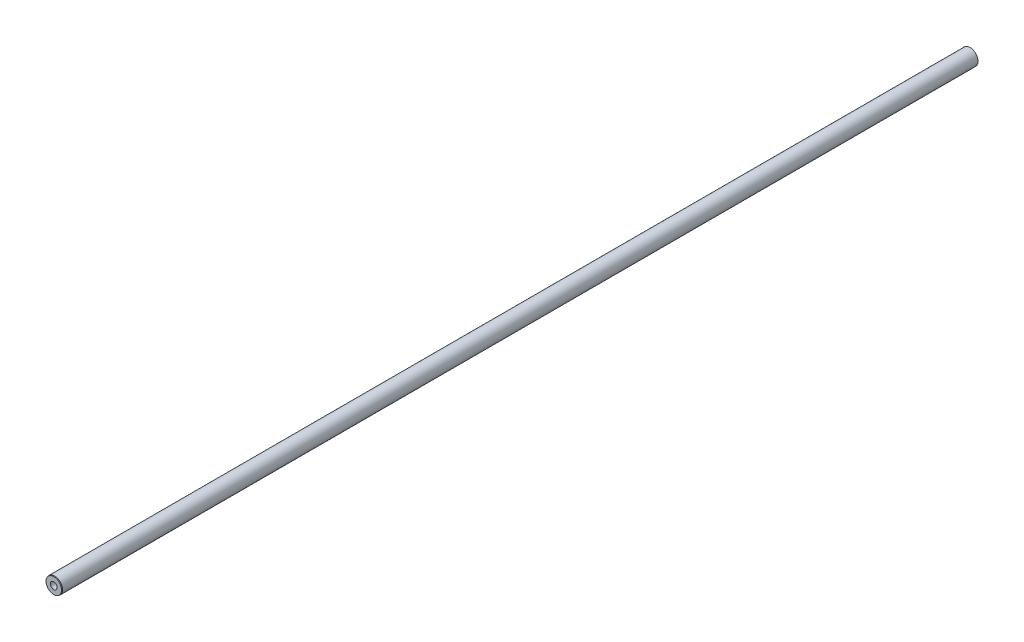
SolidWorks part; units mm, degrees
ref_plane "Front Plane" through (0, 0, 0) normal (0, 0, 1) x (1, 0, 0)
ref_plane "Top Plane" through (0, 0, 0) normal (0, 1, 0) x (1, 0, 0)
ref_plane "Right Plane" through (0, 0, 0) normal (1, 0, 0) x (0, 0, -1)
imported_body "Imported1"
sketch "Sketch1" plane through (0, 0, 0) normal (0, 0, -1) x (-1, 0, 0)
  circle A1 centre (0, 0) radius 12.7
  circle A2 centre (0, 0) radius 12.7
  dimension "D1" = 0
extrude "Boss-Extrude1" add sketch "Sketch1" along normal blind 812.8
